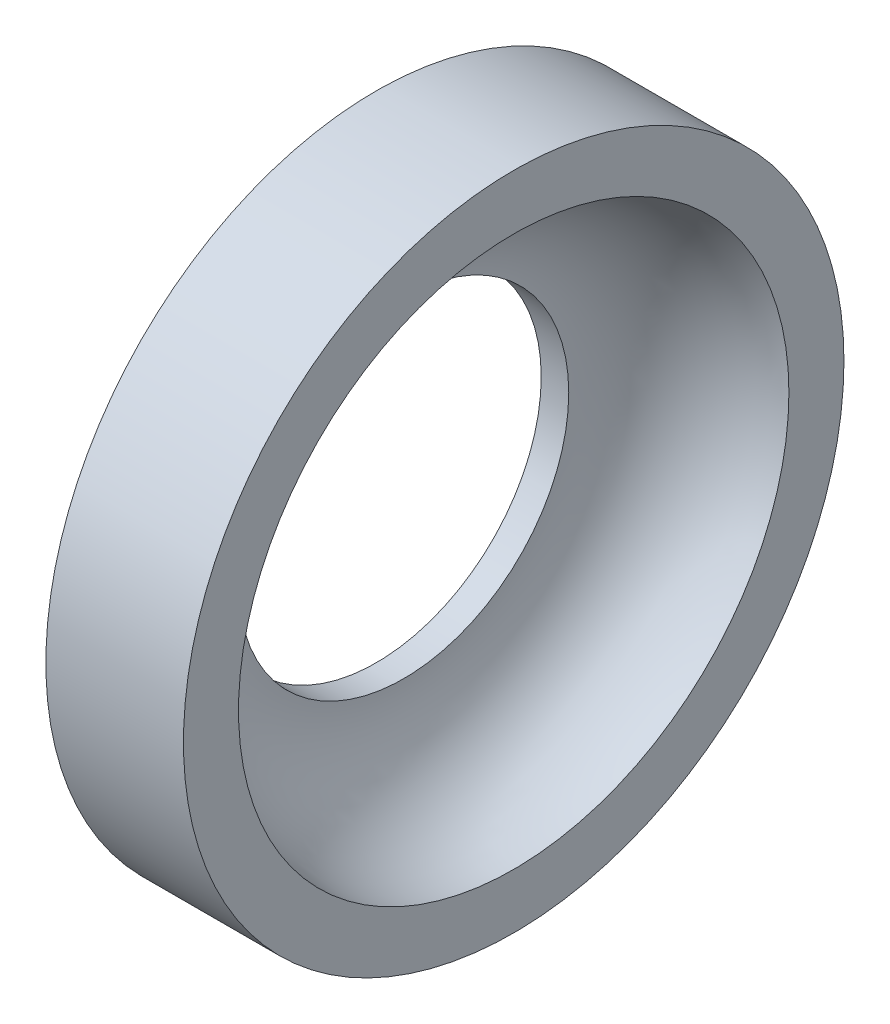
SolidWorks part; units mm, degrees
ref_plane "face" through (0, 0, 0) normal (0, 0, 1) x (1, 0, 0)
ref_plane "dessus" through (0, 0, 0) normal (0, 1, 0) x (1, 0, 0)
ref_plane "droite" through (0, 0, 0) normal (1, 0, 0) x (0, 0, -1)
sketch "Esquisse1" plane through (0, 0, 0) normal (0, 0, 1) x (1, 0, 0)
  line L0 (0, 0) -> (0, -6)
  line L1 (0, -6) -> (-2.5, -6)
  line L2 (-2.5, -6) -> (-2.5, 0)
  line L3 (0, 0) -> (-30, 0) construction
  line L4 (0, 0) -> (-2.5, 0)
  dimension "D1" = 6
  dimension "D2" = 2.5
revolve "Base-Révolution" add sketch "Esquisse1" angle 360 about L3
sketch "Esquisse2" plane through (0, 0, 0) normal (1, 0, 0) x (0, 0, -1)
  circle A0 centre (0, 0) radius 3
  dimension "D1" = 6
extrude "Enlèv. mat.-Extru.1" cut sketch "Esquisse2" against normal blind 6
sketch "Esquisse3" plane through (0, 0, 0) normal (0, 0, 1) x (1, 0, 0)
  line L5 (0, 0) -> (-10.2303, 0) construction
  line L8 (-2.5, 0) -> (0, 0) construction
  line L10 (0, 3) -> (-2.5, 3) construction
  line L11 (0, -6) -> (0, 6) construction
  line L12 (-2, 3) -> (0, 5)
  arc A0 (-2, 3) -> (0, 5) centre (0, 3) cw
revolve "Enlèvement de matière-Révolution1" cut sketch "Esquisse3" angle 360 about L5
